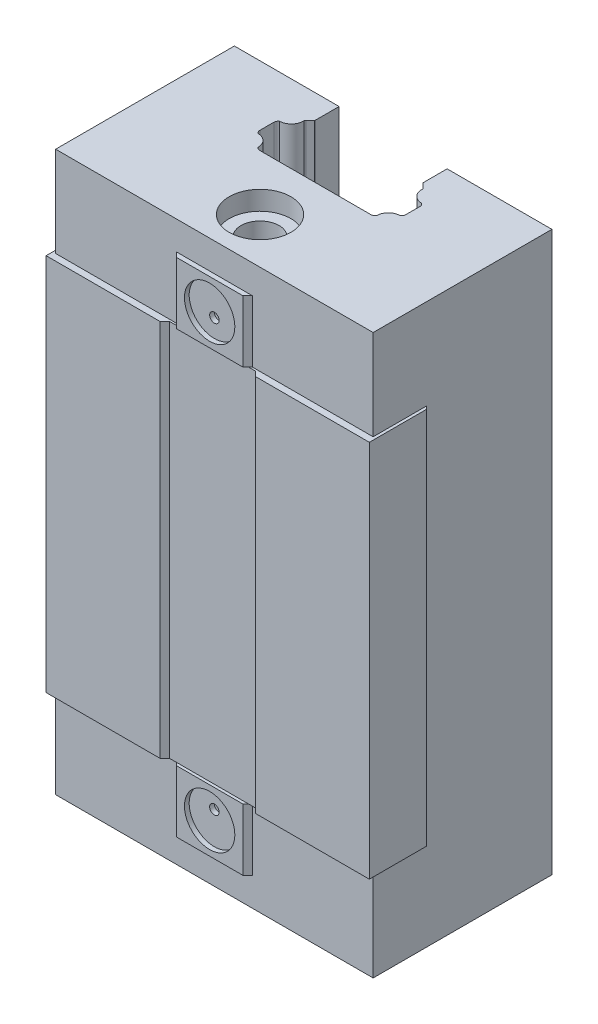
SolidWorks part; units mm, degrees
ref_plane "前视基准面" through (0, 0, 0) normal (0, 0, 1) x (1, 0, 0)
ref_plane "上视基准面" through (0, 0, 0) normal (0, 1, 0) x (1, 0, 0)
ref_plane "右视基准面" through (0, 0, 0) normal (1, 0, 0) x (0, 0, -1)
ref_plane "基准面4" through (0, 0, 2.5) normal (0, 0, -1) x (-1, 0, 0)
sketch "草图1" plane through (0, 0, 2.5) normal (0, 0, -1) x (-1, 0, 0)
  line L0 (-28, 155.9) -> (-62, 155.9)
  line L1 (-62, 155.9) -> (-62, 116.1)
  line L2 (-62, 116.1) -> (-28, 116.1)
  line L3 (-28, 116.1) -> (-28, 155.9)
extrude "凸台-拉伸1" add sketch "草图1" against normal blind 19.5
sketch "草图2" plane through (0, 155.9, 0) normal (0, 1, 0) x (-1, 0, 0)
  line L0 (-61.7, 2.5) -> (-61.7, 16)
  line L1 (-61.7, 16) -> (-62, 16)
  line L2 (-62, 16) -> (-62, 2.5)
  line L3 (-62, 2.5) -> (-61.7, 2.5)
extrude "切除-拉伸1" cut sketch "草图2" against normal through all
sketch "草图3" plane through (0, 155.9, 0) normal (0, 1, 0) x (-1, 0, 0)
  line L0 (-61.7, 2.5) -> (-61.7, 21.3)
  line L1 (-61.7, 21.3) -> (-28.3, 21.3)
  line L2 (-28.3, 21.3) -> (-28.3, 2.5)
  line L3 (-28.3, 2.5) -> (-61.7, 2.5)
extrude "凸台-拉伸2" add sketch "草图3" along normal blind 8.5
sketch "草图4" plane through (0, 116.1, 0) normal (0, -1, 0) x (1, 0, 0)
  line L0 (61.7, 2.5) -> (28.3, 2.5)
  line L1 (28.3, 2.5) -> (28.3, 21.3)
  line L2 (28.3, 21.3) -> (61.7, 21.3)
  line L3 (61.7, 21.3) -> (61.7, 2.5)
extrude "凸台-拉伸3" add sketch "草图4" along normal blind 8.5
sketch "草图5" plane through (0, 155.9, 0) normal (0, 1, 0) x (-1, 0, 0)
  line L0 (-40.5, 22) -> (-49.5, 22)
  line L1 (-49.5, 22) -> (-49.5, 21.5)
  line L2 (-49.5, 21.5) -> (-40.5, 21.5)
  line L3 (-40.5, 21.5) -> (-40.5, 22)
extrude "切除-拉伸2" cut sketch "草图5" against normal through all
sketch "草图6" plane through (0, 0, 21.3) normal (0, 0, 1) x (1, 0, 0)
  line L0 (49, 155.9) -> (41, 155.9)
  line L1 (41, 155.9) -> (41, 162.4)
  line L2 (41, 162.4) -> (49, 162.4)
  line L3 (49, 162.4) -> (49, 155.9)
extrude "凸台-拉伸4" add sketch "草图6" along normal blind 0.2
sketch "草图7" plane through (0, 0, 21.5) normal (0, 0, 1) x (1, 0, 0)
  line L0 (41, 155.9) -> (41, 162.4)
  line L1 (41, 162.4) -> (49, 162.4)
  line L2 (49, 162.4) -> (49, 155.9)
  line L3 (49, 155.9) -> (41, 155.9)
extrude "凸台-拉伸5" add sketch "草图7" along normal blind 0.3
sketch "草图8" plane through (0, 0, 21.3) normal (0, 0, 1) x (1, 0, 0)
  line L0 (49, 109.6) -> (41, 109.6)
  line L1 (41, 109.6) -> (41, 116.1)
  line L2 (41, 116.1) -> (49, 116.1)
  line L3 (49, 116.1) -> (49, 109.6)
extrude "凸台-拉伸6" add sketch "草图8" along normal blind 0.2
sketch "草图9" plane through (0, 0, 21.5) normal (0, 0, 1) x (1, 0, 0)
  line L0 (41, 116.1) -> (49, 116.1)
  line L1 (49, 116.1) -> (49, 109.6)
  line L2 (49, 109.6) -> (41, 109.6)
  line L3 (41, 109.6) -> (41, 116.1)
extrude "凸台-拉伸7" add sketch "草图9" along normal blind 0.3
sketch "草图10" plane through (0, 107.6, 0) normal (0, -1, 0) x (1, 0, 0)
  line L0 (50.68, 2.5) -> (50.68, 5.0317)
  line L1 (50.68, 5.0317) -> (51.1464, 5.4981)
  line L2 (52.68, 7.3694) -> (52.68, 8.8306)
  line L3 (50.8306, 10.68) -> (39.1694, 10.68)
  line L4 (37.32, 8.8306) -> (37.32, 7.3694)
  line L5 (38.8536, 5.4981) -> (39.32, 5.0317)
  line L6 (39.32, 5.0317) -> (39.32, 2.5)
  line L7 (39.32, 2.5) -> (50.68, 2.5)
  arc A0 (51.1464, 5.4981) -> (51.2337, 5.6177) centre (50.807, 5.8375) ccw
  arc A1 (51.2337, 5.6177) -> (52.4668, 6.9704) centre (52.4795, 5.7205) cw
  arc A2 (52.4668, 6.9704) -> (52.68, 7.3694) centre (52.2, 7.3694) ccw
  arc A3 (52.68, 8.8306) -> (52.4668, 9.2296) centre (52.2, 8.8306) ccw
  arc A4 (52.4668, 9.2296) -> (51.2296, 10.4668) centre (52.4795, 10.4795) cw
  arc A5 (51.2296, 10.4668) -> (50.8306, 10.68) centre (50.8306, 10.2) ccw
  arc A6 (39.1694, 10.68) -> (38.7704, 10.4668) centre (39.1694, 10.2) ccw
  arc A7 (38.7704, 10.4668) -> (37.5332, 9.2296) centre (37.5205, 10.4795) cw
  arc A8 (37.5332, 9.2296) -> (37.32, 8.8306) centre (37.8, 8.8306) ccw
  arc A9 (37.32, 7.3694) -> (37.5332, 6.9704) centre (37.8, 7.3694) ccw
  arc A10 (37.5332, 6.9704) -> (38.7663, 5.6177) centre (37.5205, 5.7205) cw
  arc A11 (38.7663, 5.6177) -> (38.8536, 5.4981) centre (39.193, 5.8375) ccw
extrude "切除-拉伸3" cut sketch "草图10" against normal through all
draft "拔模1" type of draft neutral plane draft angle 45 faces to draft 1 parameters "D1"=45
draft "拔模2" type of draft neutral plane draft angle 45 faces to draft 2 parameters "D1"=45
draft "拔模3" type of draft neutral plane draft angle 45 faces to draft 2 parameters "D1"=45
draft "拔模4" type of draft neutral plane draft angle 45 faces to draft 2 parameters "D1"=45
hole_wizard "M3 间隙孔1" positions "草图12" profile "草图11" hole size "M3" standard "Ansi Metric"
sketch "草图12" plane through (61.7, 0, 0) normal (1, 0, 0) x (0, 0, -1)
  point P0 (-16, 112.6)
  point P1 (-16, 159.4)
sketch "草图11" plane through (61.7, 112.6, 16) normal (0, 1, 0) x (0, 0, -1)
  line L0 (0, 0) -> (0, 4.5)
  line L1 (0, 4.5) -> (1.675, 4.5)
  line L2 (1.675, 4.5) -> (1.675, 0)
  line L5 (1.675, 0) -> (0, 0)
  line L10 (0, 4.5) -> (-1.675, 4.5) construction
  line L11 (0, -6.35) -> (0, 107.95) construction
  dimension "孔直径" = 3.35
  dimension "孔深度" = 4.5
  dimension "导头角度" = 180
hole_wizard "M3 间隙孔2" positions "草图14" profile "草图13" hole size "M3" standard "Ansi Metric"
sketch "草图14" plane through (28.3, 0, 0) normal (-1, 0, 0) x (0, 0, 1)
  point P0 (16, 159.4)
  point P1 (16, 112.6)
sketch "草图13" plane through (28.3, 159.4, 16) normal (0, 1, 0) x (0, 0, 1)
  line L0 (0, 0) -> (0, 4.5)
  line L1 (0, 4.5) -> (1.675, 4.5)
  line L2 (1.675, 4.5) -> (1.675, 0)
  line L5 (1.675, 0) -> (0, 0)
  line L10 (0, 4.5) -> (-1.675, 4.5) construction
  line L11 (0, -6.35) -> (0, 107.95) construction
  dimension "孔直径" = 3.35
  dimension "孔深度" = 4.5
  dimension "导头角度" = 180
hole_wizard "M3.5 六角头机械螺钉的柱形沉头孔1" positions "草图16" profile "草图15" counterbore size "M3.5" standard "Ansi Metric"
sketch "草图16" plane through (0, 107.6, 0) normal (0, -1, 0) x (-1, 0, 0)
  point P0 (-45, -16.5)
sketch "草图15" plane through (45, 107.6, 16.5) normal (1, 0, 0) x (0, 0, -1)
  line L0 (0, 0) -> (0, 5.4)
  line L1 (0, 5.4) -> (2, 5.4)
  line L2 (2, 5.4) -> (2, 1)
  line L3 (2, 1) -> (3.25, 1)
  line L4 (3.25, 1) -> (3.25, 0)
  line L5 (3.25, 0) -> (0, 0)
  line L10 (0, 5.4) -> (-2, 5.4) construction
  line L11 (0, -6.35) -> (0, 107.95) construction
  dimension "孔直径" = 4
  dimension "孔深度" = 5.4
  dimension "柱形沉头孔直径" = 6.5
  dimension "柱形沉头孔深度" = 1
  dimension "导头角度" = 180
hole_wizard "M3.5 六角头机械螺钉的柱形沉头孔2" positions "草图18" profile "草图17" counterbore size "M3.5" standard "Ansi Metric"
sketch "草图18" plane through (0, 164.4, 0) normal (0, 1, 0) x (1, 0, 0)
  point P0 (45, -16.5)
sketch "草图17" plane through (45, 164.4, 16.5) normal (1, 0, 0) x (0, 0, 1)
  line L0 (0, 0) -> (0, 5.4)
  line L1 (0, 5.4) -> (2, 5.4)
  line L2 (2, 5.4) -> (2, 1)
  line L3 (2, 1) -> (3.25, 1)
  line L4 (3.25, 1) -> (3.25, 0)
  line L5 (3.25, 0) -> (0, 0)
  line L10 (0, 5.4) -> (-2, 5.4) construction
  line L11 (0, -6.35) -> (0, 107.95) construction
  dimension "孔直径" = 4
  dimension "孔深度" = 5.4
  dimension "柱形沉头孔直径" = 6.5
  dimension "柱形沉头孔深度" = 1
  dimension "导头角度" = 180
hole_wizard "Ø4.0 (4) 直径孔1" positions "草图20" profile "草图19" hole size "Ø4.0" standard "Ansi Metric"
sketch "草图20" plane through (0, 0, 22) normal (0, 0, 1) x (1, 0, 0)
  point P0 (32, 149)
  point P1 (32, 123)
  point P2 (58, 149)
  point P3 (58, 123)
sketch "草图19" plane through (32, 149, 22) normal (1, 0, 0) x (0, -1, 0)
  line L0 (0, 0) -> (0, 6)
  line L1 (0, 6) -> (2, 6)
  line L2 (2, 6) -> (2, 0)
  line L5 (2, 0) -> (0, 0)
  line L10 (0, 6) -> (-2, 6) construction
  line L11 (0, -6.35) -> (0, 107.95) construction
  dimension "孔直径" = 4
  dimension "孔深度" = 6
  dimension "导头角度" = 180
hole_wizard "Ø5.3 (5.3) 直径孔1" positions "草图22" profile "草图21" hole size "Ø5.3" standard "Ansi Metric"
sketch "草图22" plane through (0, 0, 21.8) normal (0, 0, 1) x (1, 0, 0)
  point P0 (45, 159.15)
  point P1 (45, 112.85)
sketch "草图21" plane through (45, 159.15, 21.8) normal (1, 0, 0) x (0, -1, 0)
  line L0 (0, 0) -> (0, 0.5)
  line L1 (0, 0.5) -> (2.65, 0.5)
  line L2 (2.65, 0.5) -> (2.65, 0)
  line L5 (2.65, 0) -> (0, 0)
  line L10 (0, 0.5) -> (-2.65, 0.5) construction
  line L11 (0, -6.35) -> (0, 107.95) construction
  dimension "孔直径" = 5.3
  dimension "孔深度" = 0.5
  dimension "导头角度" = 180
hole_wizard "Ø1.0 (1) 直径孔1" positions "草图24" profile "草图23" hole size "Ø1.0" standard "Ansi Metric"
sketch "草图24" plane through (0, 0, 21.3) normal (0, 0, 1) x (1, 0, 0)
  point P0 (45, 158.4)
  point P1 (45, 113.6)
sketch "草图23" plane through (45, 158.4, 21.3) normal (1, 0, 0) x (0, -1, 0)
  line L0 (0, 0) -> (0, 0.5)
  line L1 (0, 0.5) -> (0.5, 0.5)
  line L2 (0.5, 0.5) -> (0.5, 0)
  line L5 (0.5, 0) -> (0, 0)
  line L10 (0, 0.5) -> (-0.5, 0.5) construction
  line L11 (0, -6.35) -> (0, 107.95) construction
  dimension "孔直径" = 1
  dimension "孔深度" = 0.5
  dimension "导头角度" = 180
fillet "圆角1" radius 0.12 2 edges at (39.32, 136, 5.0317) (50.68, 136, 5.0317)
sketch "草图25" plane through (28, 0, 0) normal (-1, 0, 0) x (0, 0, 1)
  line L0 (21.3, 116.1) -> (2.5, 116.1) construction
  line L1 (2.5, 155.9) -> (16, 155.9)
  line L2 (2.5, 155.9) -> (2.5, 116.1)
  line L3 (2.5, 116.1) -> (16, 116.1)
  line L4 (16, 155.9) -> (16, 116.1)
  dimension "D1" = 13.5
extrude "切除-拉伸4" cut sketch "草图25" against normal blind 0.3
sketch "草图26" plane through (0, 107.6, 0) normal (0, -1, 0) x (1, 0, 0)
  line L12 (39.32, 2.5) -> (39.32, 4.982)
  line L13 (39.2849, 5.0668) -> (38.8536, 5.4981)
  line L14 (37.32, 7.3694) -> (37.32, 8.8306)
  line L15 (39.1694, 10.68) -> (50.8306, 10.68)
  line L16 (52.68, 8.8306) -> (52.68, 7.3694)
  line L17 (51.1464, 5.4981) -> (50.7151, 5.0668)
  line L18 (50.68, 4.982) -> (50.68, 2.5)
  line L19 (50.68, 2.5) -> (61.7, 2.5)
  line L20 (61.7, 2.5) -> (61.7, 21.3)
  line L21 (61.7, 21.3) -> (28.3, 21.3)
  line L22 (28.3, 21.3) -> (28.3, 2.5)
  line L23 (28.3, 2.5) -> (39.32, 2.5)
  line L24 (39.32, 2.5) -> (39.32, 4.982)
  line L25 (39.2849, 5.0668) -> (38.8536, 5.4981)
  line L26 (37.32, 7.3694) -> (37.32, 8.8306)
  line L27 (39.1694, 10.68) -> (50.8306, 10.68)
  line L28 (52.68, 8.8306) -> (52.68, 7.3694)
  line L29 (51.1464, 5.4981) -> (50.7151, 5.0668)
  line L30 (50.68, 4.982) -> (50.68, 2.5)
  line L31 (50.68, 2.5) -> (61.7, 2.5)
  line L32 (61.7, 2.5) -> (61.7, 21.3)
  line L33 (61.7, 21.3) -> (28.3, 21.3)
  line L34 (28.3, 21.3) -> (28.3, 2.5)
  line L35 (28.3, 2.5) -> (39.32, 2.5)
  circle A0 centre (45, 16.5) radius 3.25 construction
  circle A1 centre (45, 16.5) radius 3.25
  arc A14 (39.32, 4.982) -> (39.2849, 5.0668) centre (39.2, 4.982) ccw
  arc A15 (38.7663, 5.6177) -> (38.8536, 5.4981) centre (39.193, 5.8375) ccw
  arc A16 (38.7663, 5.6177) -> (37.5332, 6.9704) centre (37.5205, 5.7205) ccw
  arc A17 (37.32, 7.3694) -> (37.5332, 6.9704) centre (37.8, 7.3694) ccw
  arc A18 (37.5332, 9.2296) -> (37.32, 8.8306) centre (37.8, 8.8306) ccw
  arc A19 (37.5332, 9.2296) -> (38.7704, 10.4668) centre (37.5205, 10.4795) ccw
  arc A20 (39.1694, 10.68) -> (38.7704, 10.4668) centre (39.1694, 10.2) ccw
  arc A21 (51.2296, 10.4668) -> (50.8306, 10.68) centre (50.8306, 10.2) ccw
  arc A22 (51.2296, 10.4668) -> (52.4668, 9.2296) centre (52.4795, 10.4795) ccw
  arc A23 (52.68, 8.8306) -> (52.4668, 9.2296) centre (52.2, 8.8306) ccw
  arc A24 (52.4668, 6.9704) -> (52.68, 7.3694) centre (52.2, 7.3694) ccw
  arc A25 (52.4668, 6.9704) -> (51.2337, 5.6177) centre (52.4795, 5.7205) ccw
  arc A26 (51.1464, 5.4981) -> (51.2337, 5.6177) centre (50.807, 5.8375) ccw
  arc A27 (50.7151, 5.0668) -> (50.68, 4.982) centre (50.8, 4.982) ccw
  arc A28 (39.32, 4.982) -> (39.2849, 5.0668) centre (39.2, 4.982) ccw
  arc A29 (38.7663, 5.6177) -> (38.8536, 5.4981) centre (39.193, 5.8375) ccw
  arc A30 (38.7663, 5.6177) -> (37.5332, 6.9704) centre (37.5205, 5.7205) ccw
  arc A31 (37.32, 7.3694) -> (37.5332, 6.9704) centre (37.8, 7.3694) ccw
  arc A32 (37.5332, 9.2296) -> (37.32, 8.8306) centre (37.8, 8.8306) ccw
  arc A33 (37.5332, 9.2296) -> (38.7704, 10.4668) centre (37.5205, 10.4795) ccw
  arc A34 (39.1694, 10.68) -> (38.7704, 10.4668) centre (39.1694, 10.2) ccw
  arc A35 (51.2296, 10.4668) -> (50.8306, 10.68) centre (50.8306, 10.2) ccw
  arc A36 (51.2296, 10.4668) -> (52.4668, 9.2296) centre (52.4795, 10.4795) ccw
  arc A37 (52.68, 8.8306) -> (52.4668, 9.2296) centre (52.2, 8.8306) ccw
  arc A38 (52.4668, 6.9704) -> (52.68, 7.3694) centre (52.2, 7.3694) ccw
  arc A39 (52.4668, 6.9704) -> (51.2337, 5.6177) centre (52.4795, 5.7205) ccw
  arc A40 (51.1464, 5.4981) -> (51.2337, 5.6177) centre (50.807, 5.8375) ccw
  arc A41 (50.7151, 5.0668) -> (50.68, 4.982) centre (50.8, 4.982) ccw
  dimension "D1" = 0
extrude "凸台-拉伸8" add sketch "草图26" along normal blind 1
sketch "草图27" plane through (0, 164.4, 0) normal (0, 1, 0) x (1, 0, 0)
  line L12 (38.8536, -5.4981) -> (39.2849, -5.0668)
  line L13 (39.32, -4.982) -> (39.32, -2.5)
  line L14 (39.32, -2.5) -> (28.3, -2.5)
  line L15 (28.3, -2.5) -> (28.3, -21.3)
  line L16 (28.3, -21.3) -> (61.7, -21.3)
  line L17 (61.7, -21.3) -> (61.7, -2.5)
  line L18 (61.7, -2.5) -> (50.68, -2.5)
  line L19 (50.68, -2.5) -> (50.68, -4.982)
  line L20 (50.7151, -5.0668) -> (51.1464, -5.4981)
  line L21 (52.68, -7.3694) -> (52.68, -8.8306)
  line L22 (50.8306, -10.68) -> (39.1694, -10.68)
  line L23 (37.32, -8.8306) -> (37.32, -7.3694)
  line L24 (38.8536, -5.4981) -> (39.2849, -5.0668)
  line L25 (39.32, -4.982) -> (39.32, -2.5)
  line L26 (39.32, -2.5) -> (28.3, -2.5)
  line L27 (28.3, -2.5) -> (28.3, -21.3)
  line L28 (28.3, -21.3) -> (61.7, -21.3)
  line L29 (61.7, -21.3) -> (61.7, -2.5)
  line L30 (61.7, -2.5) -> (50.68, -2.5)
  line L31 (50.68, -2.5) -> (50.68, -4.982)
  line L32 (50.7151, -5.0668) -> (51.1464, -5.4981)
  line L33 (52.68, -7.3694) -> (52.68, -8.8306)
  line L34 (50.8306, -10.68) -> (39.1694, -10.68)
  line L35 (37.32, -8.8306) -> (37.32, -7.3694)
  circle A0 centre (45, -16.5) radius 3.25 construction
  circle A1 centre (45, -16.5) radius 3.25
  arc A14 (39.2849, -5.0668) -> (39.32, -4.982) centre (39.2, -4.982) ccw
  arc A15 (50.68, -4.982) -> (50.7151, -5.0668) centre (50.8, -4.982) ccw
  arc A16 (51.2337, -5.6177) -> (51.1464, -5.4981) centre (50.807, -5.8375) ccw
  arc A17 (51.2337, -5.6177) -> (52.4668, -6.9704) centre (52.4795, -5.7205) ccw
  arc A18 (52.68, -7.3694) -> (52.4668, -6.9704) centre (52.2, -7.3694) ccw
  arc A19 (52.4668, -9.2296) -> (52.68, -8.8306) centre (52.2, -8.8306) ccw
  arc A20 (52.4668, -9.2296) -> (51.2296, -10.4668) centre (52.4795, -10.4795) ccw
  arc A21 (50.8306, -10.68) -> (51.2296, -10.4668) centre (50.8306, -10.2) ccw
  arc A22 (38.7704, -10.4668) -> (39.1694, -10.68) centre (39.1694, -10.2) ccw
  arc A23 (38.7704, -10.4668) -> (37.5332, -9.2296) centre (37.5205, -10.4795) ccw
  arc A24 (37.32, -8.8306) -> (37.5332, -9.2296) centre (37.8, -8.8306) ccw
  arc A25 (37.5332, -6.9704) -> (37.32, -7.3694) centre (37.8, -7.3694) ccw
  arc A26 (37.5332, -6.9704) -> (38.7663, -5.6177) centre (37.5205, -5.7205) ccw
  arc A27 (38.8536, -5.4981) -> (38.7663, -5.6177) centre (39.193, -5.8375) ccw
  arc A28 (39.2849, -5.0668) -> (39.32, -4.982) centre (39.2, -4.982) ccw
  arc A29 (50.68, -4.982) -> (50.7151, -5.0668) centre (50.8, -4.982) ccw
  arc A30 (51.2337, -5.6177) -> (51.1464, -5.4981) centre (50.807, -5.8375) ccw
  arc A31 (51.2337, -5.6177) -> (52.4668, -6.9704) centre (52.4795, -5.7205) ccw
  arc A32 (52.68, -7.3694) -> (52.4668, -6.9704) centre (52.2, -7.3694) ccw
  arc A33 (52.4668, -9.2296) -> (52.68, -8.8306) centre (52.2, -8.8306) ccw
  arc A34 (52.4668, -9.2296) -> (51.2296, -10.4668) centre (52.4795, -10.4795) ccw
  arc A35 (50.8306, -10.68) -> (51.2296, -10.4668) centre (50.8306, -10.2) ccw
  arc A36 (38.7704, -10.4668) -> (39.1694, -10.68) centre (39.1694, -10.2) ccw
  arc A37 (38.7704, -10.4668) -> (37.5332, -9.2296) centre (37.5205, -10.4795) ccw
  arc A38 (37.32, -8.8306) -> (37.5332, -9.2296) centre (37.8, -8.8306) ccw
  arc A39 (37.5332, -6.9704) -> (37.32, -7.3694) centre (37.8, -7.3694) ccw
  arc A40 (37.5332, -6.9704) -> (38.7663, -5.6177) centre (37.5205, -5.7205) ccw
  arc A41 (38.8536, -5.4981) -> (38.7663, -5.6177) centre (39.193, -5.8375) ccw
  dimension "D1" = 0
extrude "凸台-拉伸9" add sketch "草图27" along normal blind 1
